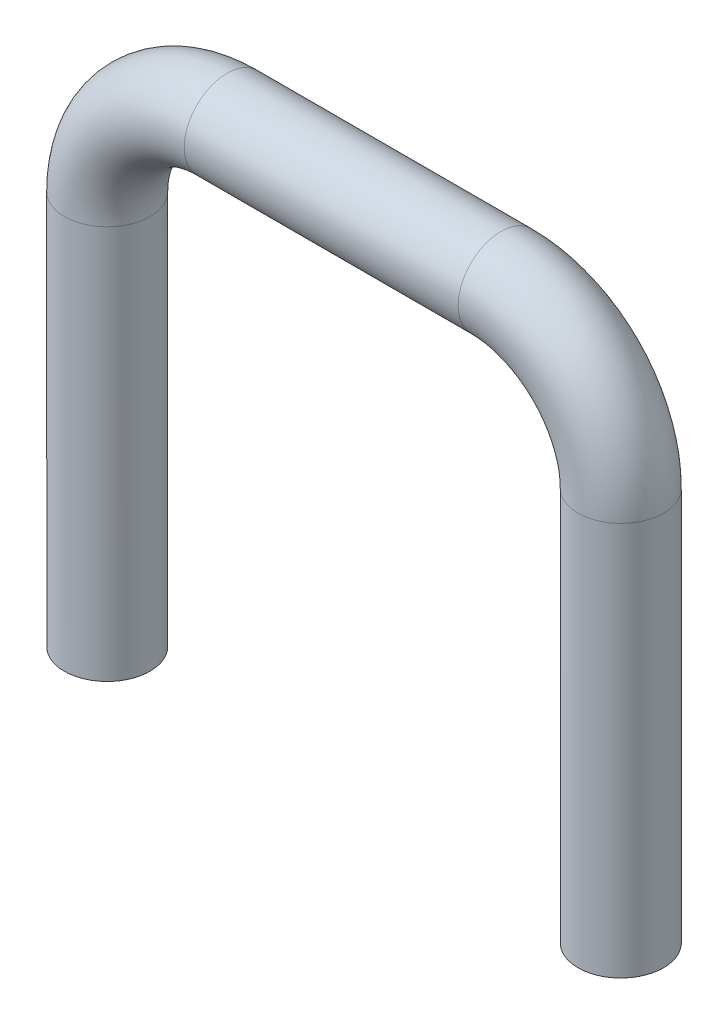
SolidWorks part; units mm, degrees
ref_plane "Front" through (0, 0, 0) normal (0, 0, 1) x (1, 0, 0)
ref_plane "Top" through (0, 0, 0) normal (0, 1, 0) x (1, 0, 0)
ref_plane "Right" through (0, 0, 0) normal (1, 0, 0) x (0, 0, -1)
sketch "Sketch1" plane through (0, 0, 0) normal (0, 0, 1) x (1, 0, 0)
  line L0 (0, 0) -> (0, 38.6687) construction
  line L1 (-8, 30) -> (8, 30)
  line L2 (15, 23) -> (15, 0)
  line L3 (-15, 23) -> (-15, 0)
  arc A0 (15, 23) -> (8, 30) centre (8, 23) ccw
  arc A1 (-15, 23) -> (-8, 30) centre (-8, 23) cw
  point P12 (0, 30)
  dimension "D1" = 7
  dimension "D2" = 30
  dimension "D3" = 30
sketch "Sketch2" plane through (0, 0, 0) normal (0, 1, 0) x (1, 0, 0)
  circle A0 centre (15, 0) radius 2.5
  dimension "D1" = 5
sweep "Base-Sweep" add profiles "Sketch2" path "Sketch1"
